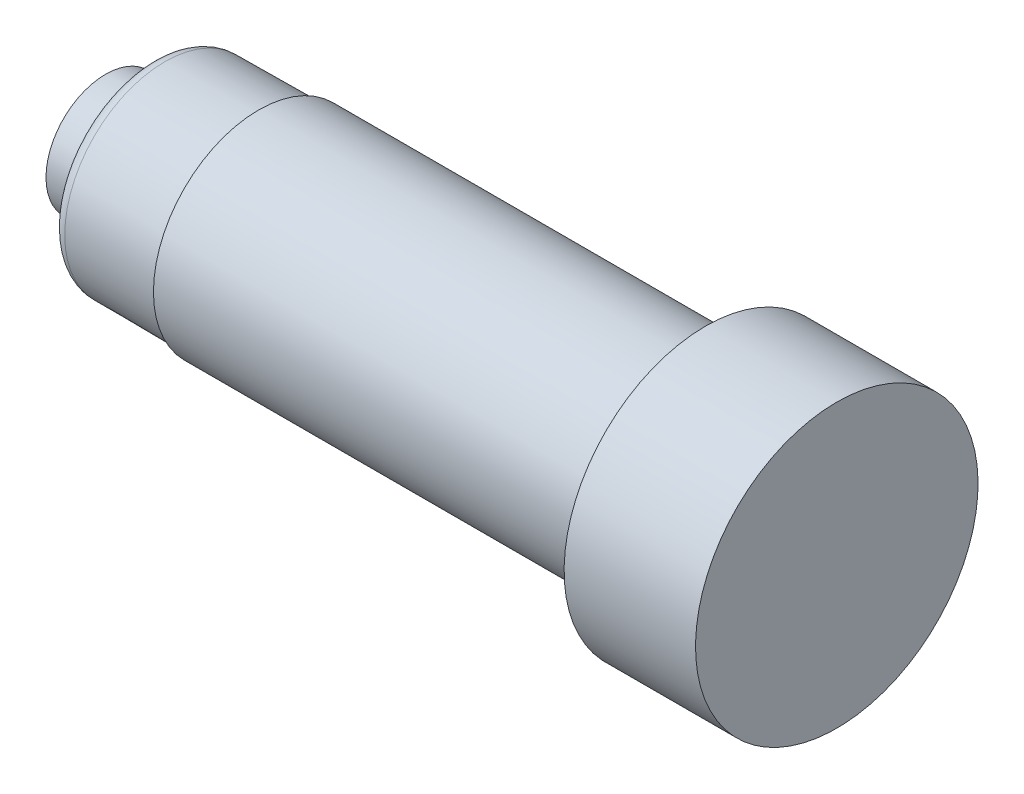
SolidWorks part; units mm, degrees
ref_plane "Plan de face" through (0, 0, 0) normal (0, 0, 1) x (1, 0, 0)
ref_plane "Plan de dessus" through (0, 0, 0) normal (0, 1, 0) x (1, 0, 0)
ref_plane "Plan de droite" through (0, 0, 0) normal (1, 0, 0) x (0, 0, -1)
sketch "Esquisse1" plane through (0, 0, 0) normal (0, 0, 1) x (1, 0, 0)
  line L0 (93, 0) -> (54.9412, 0) construction
  line L1 (77, 0) -> (-77, 0) construction
  line L2 (87, 5.375) -> (82, 5.375)
  line L3 (87, 0) -> (87, 14) construction
  line L4 (82, 6) -> (82, 11) construction
  line L5 (82, 5.375) -> (82, 4)
  line L6 (82, 4) -> (65, 4)
  line L7 (65, 4) -> (65, 3.8417)
  line L8 (65, 4.5675) -> (65, 1.5491) construction
  line L9 (65, 3.8417) -> (60.94, 3.8062)
  line L10 (60.94, 3.8062) -> (60.94, 2.2836)
  line L11 (58.93, 0) -> (58.93, 2.266)
  line L13 (58.93, 2.266) -> (60.94, 2.2836)
  line L14 (93, 3) -> (93, -3) construction
  line L15 (87, 5.375) -> (87, 0)
  line L16 (58.93, 0) -> (87, 0)
  line L17 (77, 0) -> (-77, 0) construction
  dimension "D1" = 0.5
  dimension "D2" = 0.5
  dimension "D3" = 4.06
  dimension "D4" = 4.5321
  dimension "D5" = 7.6125
  dimension "D6" = 10.75
  dimension "D7" = 23.07
revolve "Révolution1" add sketch "Esquisse1" angle 360 about L0
fillet "Congé1" radius 0.5 3 edges at (60.94, 2.2836, 0) (60.94, 3.8062, 0) (82, 4, 0)
sketch "Esquisse2" plane through (58.93, 0, 0) normal (-1, 0, 0) x (0, 0, 1)
  circle A0 centre (0, 0) radius 6.3859
extrude "Enlèv. mat.-Extru.1" cut sketch "Esquisse2" against normal blind 0.25
